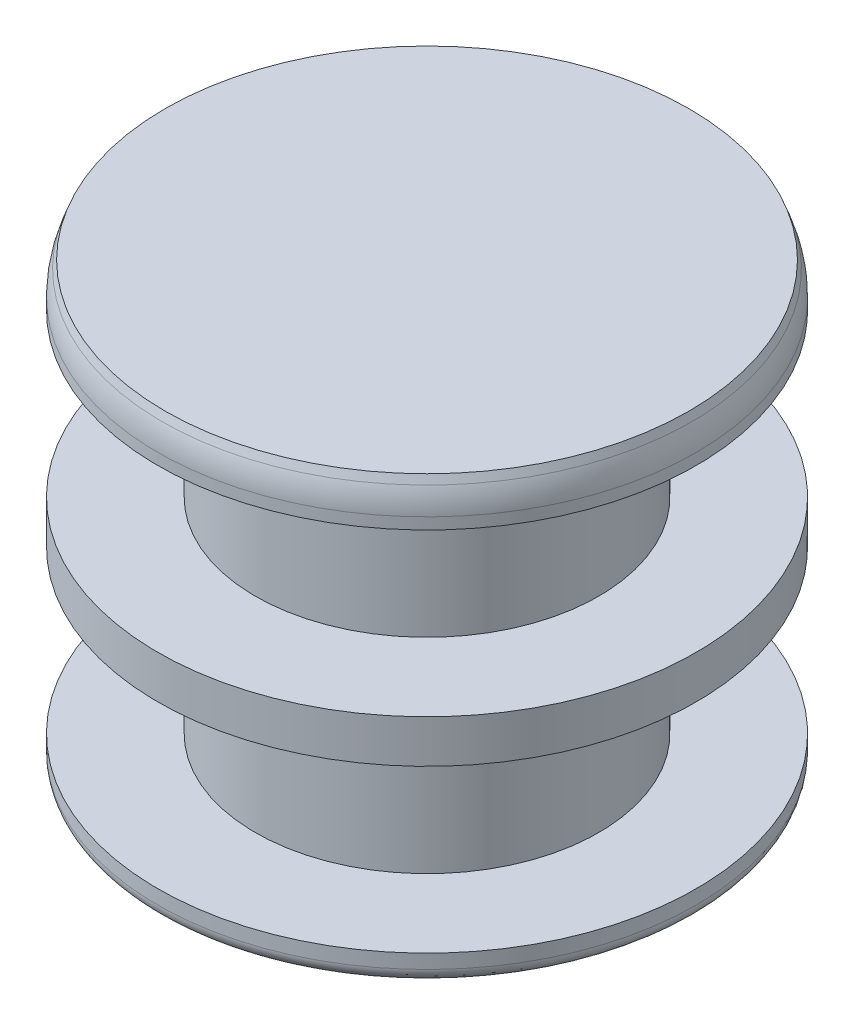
SolidWorks part; units mm, degrees
ref_plane "X_Y" through (0, 0, 0) normal (0, 0, 1) x (1, 0, 0)
ref_plane "Z_X" through (0, 0, 0) normal (0, 1, 0) x (1, 0, 0)
ref_plane "Y_Z" through (0, 0, 0) normal (1, 0, 0) x (0, 0, -1)
sketch "Sketch1" plane through (0, 0, 0) normal (0, 0, 1) x (1, 0, 0)
  line L0 (0, 0) -> (0, -7.9996)
  line L2 (0.5, -7.9996) -> (3.76, -6.0408)
  line L3 (3.76, -6.0408) -> (3.76, -5.73)
  line L4 (3.76, -5.73) -> (2.4, -5.73)
  line L5 (2.4, -5.73) -> (2.4, -3.47)
  line L6 (2.4, -3.47) -> (3.76, -3.47)
  line L7 (3.76, -3.47) -> (3.76, -2.87)
  line L8 (3.66, 0) -> (0, 0)
  line L9 (0.5, -7.9996) -> (0, -7.9996)
  line L10 (3.66, 0) -> (3.76, -0.2747)
  line L11 (0, -0.5526) -> (0, -50000.5526) construction
  line L12 (3.76, -2.87) -> (2.4, -2.87)
  line L13 (2.4, -2.87) -> (2.4, -0.61)
  line L14 (2.4, -0.61) -> (3.76, -0.61)
  line L15 (3.76, -0.61) -> (3.76, -0.2747)
  point P10 (0, -8.3)
  point P12 (2.4, -4.6)
  dimension "D1" = 6.0408
  dimension "D2" = 7.52
  dimension "D3" = 59
  dimension "D4" = 0.3108
  dimension "D5" = 2.26
  dimension "D6" = 4.8
  dimension "D7" = 0.5
  dimension "D8" = 0.1
  dimension "D9" = 20
  dimension "D10" = 8.3
  dimension "D11" = 4.6
  dimension "D12" = 0.6
  dimension "D13" = 0.61
revolve "Revolve1" add sketch "Sketch1" angle 360 about L0
fillet "Fillet1" radius 0.2 1 edges at (-3.76, -6.0408, 0)
fillet "Fillet2" radius 1 1 edges at (-3.76, -0.2747, 0)
